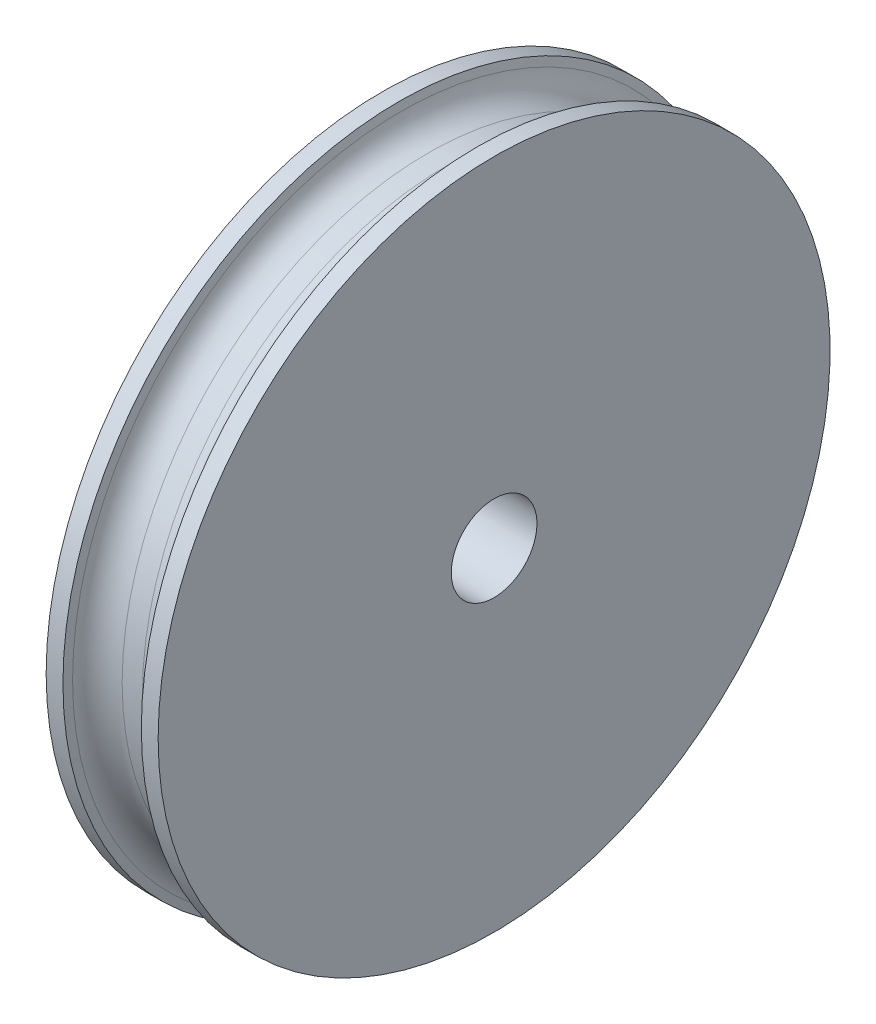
SolidWorks part; units mm, degrees
ref_plane "前视基准面" through (0, 0, 0) normal (0, 0, 1) x (1, 0, 0)
ref_plane "上视基准面" through (0, 0, 0) normal (0, 1, 0) x (1, 0, 0)
ref_plane "右视基准面" through (0, 0, 0) normal (1, 0, 0) x (0, 0, -1)
sketch "草图1" plane through (0, 0, 0) normal (0, 0, 1) x (1, 0, 0)
  line L0 (-22.6859, 0.1173) -> (22.9117, 0.1173) construction
  line L1 (0, 42.9253) -> (0, -42.3693) construction
  line L2 (-1.9999, 0.1173) -> (-1.9999, 12.1173)
  line L3 (-1.9999, 12.1173) -> (-1.3999, 12.1173)
  line L4 (-1.3999, 12.1173) -> (-1.1712, 11.0413)
  line L5 (-1.1712, 11.0413) -> (1.1714, 11.0413)
  line L6 (1.1714, 11.0413) -> (1.4001, 12.1173)
  line L7 (1.4001, 12.1173) -> (2.0001, 12.1173)
  line L8 (2.0001, 12.1173) -> (2.0001, 0.1173)
  line L9 (-1.9999, 0.1173) -> (2.0001, 0.1173)
  point P8 (0, 0)
  dimension "D1" = 4
  dimension "D2" = 102
  dimension "D3" = 102
  dimension "D4" = 0.6
  dimension "D5" = 12
  dimension "D6" = 12
  dimension "D7" = 0.6
revolve "旋转" add sketch "草图1" angle 360 about L0
fillet "圆角1" radius 1 2 edges at (-1.1712, 0.1173, 10.924) (1.1714, 0.1173, 10.924)
sketch "草图2" plane through (-1.9999, 0, 0) normal (-1, 0, 0) x (0, 0, 1)
  circle A0 centre (0, 0) radius 4.5
  dimension "D1" = 9
extrude "凸台-拉伸1" add sketch "草图2" along normal blind 0.5
sketch "草图3" plane through (-2.4999, 0, 0) normal (-1, 0, 0) x (0, 0, 1)
  circle A0 centre (0, 0) radius 1.53
  dimension "D1" = 3.06
extrude "切除-拉伸1" cut sketch "草图3" against normal blind 6
fillet "圆角2" radius 0.5 1 edges at (-2.4999, 0, 4.5)
